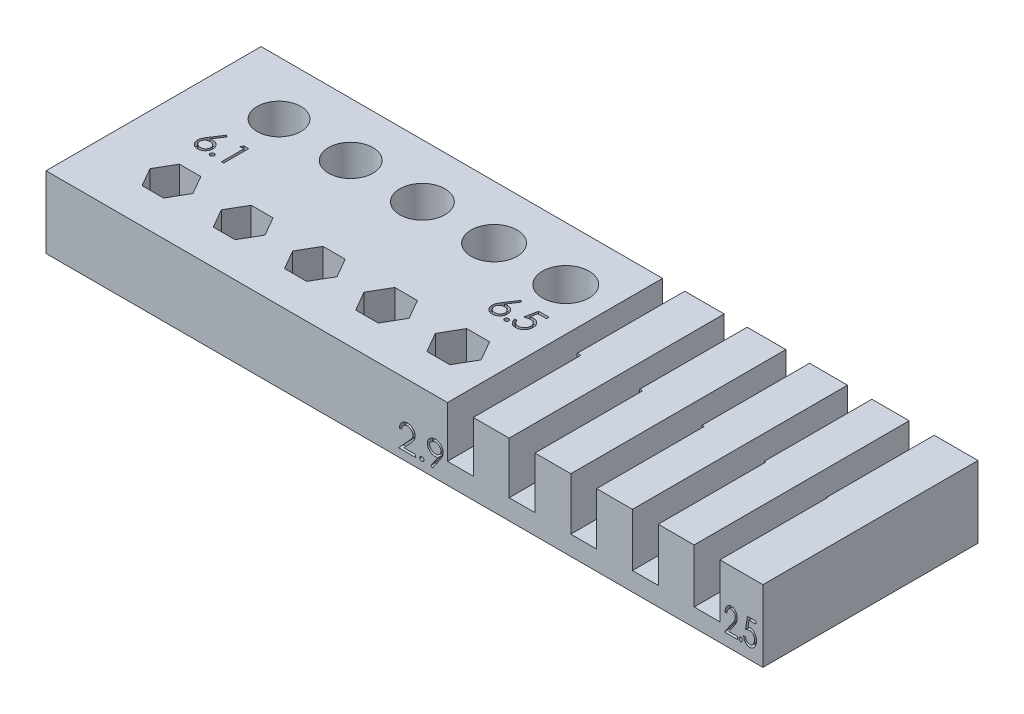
SolidWorks part; units mm, degrees
ref_plane "Alzado" through (0, 0, 0) normal (0, 0, 1) x (1, 0, 0)
ref_plane "Planta" through (0, 0, 0) normal (0, 1, 0) x (1, 0, 0)
ref_plane "Vista lateral" through (0, 0, 0) normal (1, 0, 0) x (0, 0, -1)
sketch "Croquis1" plane through (0, 0, 0) normal (0, 1, 0) x (1, 0, 0)
  line L1 (-50, -15) -> (50, -15)
  line L2 (-50, -15) -> (-50, 15)
  line L3 (-50, 15) -> (50, 15)
  line L4 (50, -15) -> (50, 15)
  line L5 (-50, -15) -> (50, 15) construction
  line L6 (-50, 15) -> (50, -15) construction
  point P0 (0, 0)
  dimension "D1" = 100
  dimension "D2" = 30
extrude "Saliente-Extruir1" add sketch "Croquis1" along normal blind 10
sketch "Croquis2" plane through (0, 10, 0) normal (0, 1, 0) x (1, 0, 0)
  line L0 (-40, 7.5) -> (-30, 7.5)
  line L1 (3.25, 7.5) -> (-3.25, 7.5)
  line L2 (-40, 7.5) -> (-40, -7.5)
  line L3 (-6.8, 7.5) -> (-13.2, 7.5)
  line L4 (-16.85, 7.5) -> (-23.15, 7.5)
  line L5 (-26.9, 7.5) -> (-33.1, 7.5)
  line L6 (-37, -7.5) -> (-38.5, -4.9019)
  line L7 (-38.5, -4.9019) -> (-41.5, -4.9019)
  line L8 (-41.5, -4.9019) -> (-43, -7.5)
  line L9 (-43.05, 7.5) -> (-36.95, 7.5)
  line L13 (-43, -7.5) -> (-41.5, -10.0981)
  line L14 (-41.5, -10.0981) -> (-38.5, -10.0981)
  line L15 (-38.5, -10.0981) -> (-37, -7.5)
  line L17 (-26.95, -7.5) -> (-28.475, -4.8586)
  line L18 (-28.475, -4.8586) -> (-31.525, -4.8586)
  line L19 (-31.525, -4.8586) -> (-33.05, -7.5)
  line L20 (-33.05, -7.5) -> (-31.525, -10.1414)
  line L21 (-31.525, -10.1414) -> (-28.475, -10.1414)
  line L22 (-28.475, -10.1414) -> (-26.95, -7.5)
  line L26 (-16.9, -7.5) -> (-18.45, -4.8153)
  line L27 (-18.45, -4.8153) -> (-21.55, -4.8153)
  line L28 (-21.55, -4.8153) -> (-23.1, -7.5)
  line L29 (-23.1, -7.5) -> (-21.55, -10.1847)
  line L30 (-21.55, -10.1847) -> (-18.45, -10.1847)
  line L31 (-18.45, -10.1847) -> (-16.9, -7.5)
  line L32 (-6.85, -7.5) -> (-8.425, -4.772)
  line L33 (-8.425, -4.772) -> (-11.575, -4.772)
  line L34 (-11.575, -4.772) -> (-13.15, -7.5)
  line L35 (-13.15, -7.5) -> (-11.575, -10.228)
  line L36 (-11.575, -10.228) -> (-8.425, -10.228)
  line L37 (-8.425, -10.228) -> (-6.85, -7.5)
  line L38 (3.2, -7.5) -> (1.6, -4.7287)
  line L39 (1.6, -4.7287) -> (-1.6, -4.7287)
  line L40 (-1.6, -4.7287) -> (-3.2, -7.5)
  line L41 (-3.2, -7.5) -> (-1.6, -10.2713)
  line L42 (-1.6, -10.2713) -> (1.6, -10.2713)
  line L43 (1.6, -10.2713) -> (3.2, -7.5)
  circle A0 centre (-40, 7.5) radius 3.05
  circle A1 centre (-30, 7.5) radius 3.1
  circle A2 centre (-20, 7.5) radius 3.15
  circle A3 centre (-10, 7.5) radius 3.2
  circle A4 centre (0, 7.5) radius 3.25
  circle A5 centre (-40, -7.5) radius 2.5981 construction
  circle A6 centre (-30, -7.5) radius 2.6414 construction
  circle A7 centre (-20, -7.5) radius 2.6847 construction
  circle A8 centre (-10, -7.5) radius 2.728 construction
  circle A9 centre (0, -7.5) radius 2.7713 construction
  dimension "D1" = 6
  dimension "D2" = 6.1
  dimension "D8" = 6.3
  dimension "D6" = 6.5
  dimension "D3" = 6.2
  dimension "D4" = 6.3
  dimension "D5" = 6.4
  dimension "D7" = 6.4
  dimension "D9" = 6.2
  dimension "D10" = 6.1
extrude "Cortar-Extruir1" cut sketch "Croquis2" against normal blind 10 contours A0 | A1 | A2 | A3 | A4 | L39 L40 L41 L42 L43 L38 | L33 L34 L35 L36 L37 L32 | L27 L28 L29 L30 L31 L26 | L18 L19 L20 L21 L22 L17 | L8 L13 L14 L15 L6 L7
sketch "Croquis3" plane through (0, 0, 15) normal (0, 0, 1) x (1, 0, 0)
  line L0 (9.6, 10) -> (14.6, 10)
  line L1 (-50, 10) -> (50, 10) construction
  line L2 (6, 10) -> (6, 2.9)
  line L3 (6, 2.9) -> (9.6, 2.9)
  line L4 (9.6, 2.9) -> (9.6, 10)
  line L5 (9.6, 10) -> (6, 10)
  line L6 (18.2, 10) -> (23.2, 10)
  line L7 (14.6, 10) -> (18.2, 10)
  line L8 (14.6, 10) -> (14.6, 2.8)
  line L9 (14.6, 2.8) -> (18.2, 2.8)
  line L10 (18.2, 10) -> (18.2, 2.8)
  line L11 (26.8, 10) -> (31.8, 10)
  line L12 (23.2, 10) -> (26.8, 10)
  line L13 (23.2, 10) -> (23.2, 2.7)
  line L14 (23.2, 2.7) -> (26.8, 2.7)
  line L15 (26.8, 10) -> (26.8, 2.7)
  line L16 (35.4, 10) -> (40.4, 10)
  line L17 (31.8, 10) -> (35.4, 10)
  line L18 (31.8, 10) -> (31.8, 2.6)
  line L19 (31.8, 2.6) -> (35.4, 2.6)
  line L20 (35.4, 10) -> (35.4, 2.6)
  line L22 (40.4, 10) -> (44, 10)
  line L23 (40.4, 10) -> (40.4, 2.5)
  line L24 (40.4, 2.5) -> (44, 2.5)
  line L25 (44, 10) -> (44, 2.5)
  dimension "D1" = 3.6
  dimension "D2" = 7.2
  dimension "D3" = 3.6
  dimension "D4" = 7.3
  dimension "D5" = 3.6
  dimension "D6" = 7.4
  dimension "D7" = 7.1
  dimension "D8" = 3.6
  dimension "D9" = 7.5
extrude "Cortar-Extruir2" cut sketch "Croquis3" against normal blind 15 contours L3 L4 L2 M15 | L10 L8 L9 M15 | L15 L13 L14 M15 | L20 L18 L19 M15 | L25 L23 L24 M15
sketch "Croquis6" plane through (0, 0, -15) normal (0, 0, -1) x (-1, 0, 0)
  line L0 (0, 10) -> (-6, 10)
  line L1 (-50, 10) -> (50, 10) construction
  line L2 (-9.1, 10) -> (-14.6, 10)
  line L3 (-6, 10) -> (-9.1, 10)
  line L4 (-6, 10) -> (-6, 2.4)
  line L5 (-6, 2.4) -> (-9.1, 2.4)
  line L6 (-9.1, 10) -> (-9.1, 2.4)
  line L7 (-17.8, 10) -> (-23.2, 10)
  line L8 (-14.6, 10) -> (-17.8, 10)
  line L9 (-14.6, 10) -> (-14.6, 2.4)
  line L10 (-14.6, 2.4) -> (-17.8, 2.4)
  line L11 (-17.8, 10) -> (-17.8, 2.4)
  line L12 (-26.5, 10) -> (-31.8, 10)
  line L13 (-23.2, 10) -> (-26.5, 10)
  line L14 (-23.2, 10) -> (-23.2, 2.4)
  line L15 (-23.2, 2.4) -> (-26.5, 2.4)
  line L16 (-26.5, 10) -> (-26.5, 2.4)
  line L17 (-35.2, 10) -> (-40.4, 10)
  line L18 (-31.8, 10) -> (-35.2, 10)
  line L19 (-31.8, 10) -> (-31.8, 2.4)
  line L20 (-31.8, 2.4) -> (-35.2, 2.4)
  line L21 (-35.2, 10) -> (-35.2, 2.4)
  line L23 (-40.4, 10) -> (-43.9, 10)
  line L24 (-40.4, 10) -> (-40.4, 2.4)
  line L25 (-40.4, 2.4) -> (-43.9, 2.4)
  line L26 (-43.9, 10) -> (-43.9, 2.4)
  dimension "D1" = 3.1
  dimension "D2" = 3.2
  dimension "D3" = 7.6
  dimension "D4" = 7.6
  dimension "D5" = 3.3
  dimension "D6" = 7.6
  dimension "D7" = 3.4
  dimension "D8" = 3.5
  dimension "D9" = 6
  dimension "D10" = 5.5
  dimension "D11" = 5.4
  dimension "D12" = 5.3
  dimension "D13" = 5.2
extrude "Cortar-Extruir4" cut sketch "Croquis6" against normal blind 15 contours L14 L15 L16 L13 | L9 L10 L11 L8 | L4 L5 L6 L3 | L24 L25 L26 L23 | L19 L20 L21 L18
sketch "Croquis7" plane through (0, 0, 15) normal (0, 0, 1) x (1, 0, 0)
  text T0 "2.9"
  text T1 "2.5" font "Century Gothic" height 3.5
extrude "Cortar-Extruir5" cut sketch "Croquis7" against normal blind 0.7
sketch "Croquis8" plane through (0, 0, -15) normal (0, 0, -1) x (-1, 0, 0)
  text T0 "3.1  " font "Century Gothic" height 3.5
  text T1 "3.5  " font "Century Gothic" height 3.5
extrude "Cortar-Extruir6" cut sketch "Croquis8" against normal blind 0.7
sketch "Croquis9" plane through (0, 10, 0) normal (0, 1, 0) x (1, 0, 0)
  text T0 "6.1  " font "Century Gothic" height 3.5
  text T1 "6.5  " font "Century Gothic" height 3.5
extrude "Cortar-Extruir7" cut sketch "Croquis9" against normal blind 0.7
